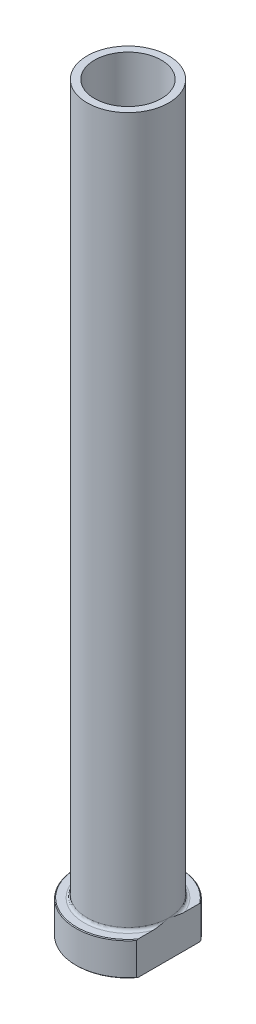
SolidWorks part; units mm, degrees
ref_plane "Front Plane" through (0, 0, 0) normal (0, 0, 1) x (1, 0, 0)
ref_plane "Top Plane" through (0, 0, 0) normal (0, 1, 0) x (1, 0, 0)
ref_plane "Right Plane" through (0, 0, 0) normal (1, 0, 0) x (0, 0, -1)
sketch "Sketch1" plane through (0, 0, 0) normal (0, 0, 1) x (1, 0, 0)
  line L0 (-9, 200) -> (-11, 200)
  line L1 (-11, 200) -> (-11, 9)
  line L2 (-11, 9) -> (-14, 9)
  line L3 (-14, 9) -> (-14, 0)
  line L4 (13.75, 0) -> (-13.75, 0) construction
  line L5 (-14, 0) -> (-9.25, 0)
  line L6 (-9, 145) -> (-9, 200)
  line L7 (0, 92.1877) -> (0, -15.5353) construction
  line L8 (0, -15.4) -> (0, 15.4) construction
  line L9 (-9, 145) -> (-9.25, 133)
  line L10 (-9.25, 133) -> (-9.25, 0)
  dimension "D1" = 0.25
  dimension "ID" = 18
  dimension "OD" = 22
  dimension "L" = 200
  dimension "H" = 28
  dimension "T" = 9
  dimension "N" = 55
  dimension "D2" = 12
  dimension "L-N" = 145
revolve "Revolve1" add sketch "Sketch1" angle 360 about L7
fillet "Fillet1" radius 0.8 1 edges at (0, 9, 11)
chamfer "Chamfer1" distance 0.2 angle 45 2 edges at (0, 9, 14) (0, 0, 14)
sketch "Sketch2" plane through (0, 0, 0) normal (0, -1, 0) x (1, 0, 0)
  line L0 (11, 8.6603) -> (11, -8.6603)
  circle A0 centre (0, 0) radius 14 construction
  arc A1 (11, 8.6603) -> (11, -8.6603) centre (0, 0) cw
  circle A2 centre (0, 0) radius 11 construction
extrude "Cut-Extrude1" cut sketch "Sketch2" against normal through all
chamfer "Chamfer2" distance 0.5 angle 45 1 edges at (0, 0, 9.25)
